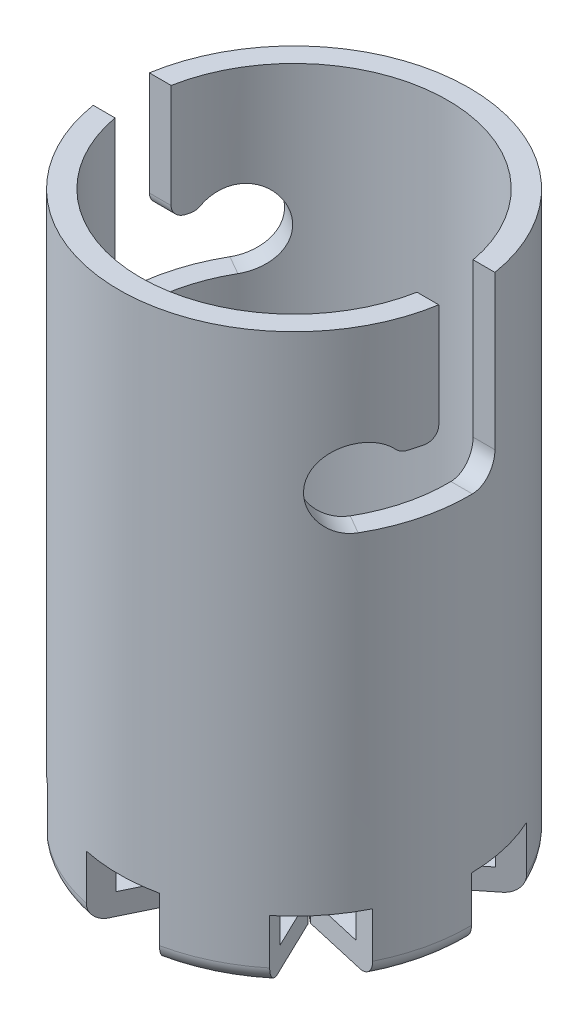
SolidWorks part; units mm, degrees
ref_plane "Front Plane" through (0, 0, 0) normal (0, 0, 1) x (1, 0, 0)
ref_plane "Top Plane" through (0, 0, 0) normal (0, 1, 0) x (1, 0, 0)
ref_plane "Right Plane" through (0, 0, 0) normal (1, 0, 0) x (0, 0, -1)
sketch "Sketch1" plane through (0, 0, 0) normal (0, 1, 0) x (1, 0, 0)
  circle A0 centre (0, 0) radius 5.3848
  dimension "D1" = 10.7696
extrude "Boss-Extrude1" add sketch "Sketch1" against normal blind 17.4752
fillet "Fillet1" radius 0.508 1 edges at (0, -17.4752, 5.3848)
shell "Shell1" thickness 0.6604
sketch "Sketch2" plane through (0, -17.4752, 0) normal (0, -1, 0) x (1, 0, 0)
  circle A0 centre (0, 0) radius 2.3813
  dimension "D1" = 4.7625
extrude "Cut-Extrude1" cut sketch "Sketch2" against normal blind 2.54
sketch "Sketch3" plane through (0, -17.4752, 0) normal (0, -1, 0) x (1, 0, 0)
  line L0 (0, 0) -> (0, -5.6585) construction
  line L1 (1.27, -5.6585) -> (1.27, 0) construction
  line L2 (-1.27, -5.6585) -> (-1.27, -0.8493) construction
  line L3 (-5.2158, -2.5351) -> (-1.4559, 0.4634) construction
  line L4 (-3.6322, -4.521) -> (0.7918, -0.9929) construction
  line L5 (-5.234, 2.4973) -> (-0.5454, 1.4272) construction
  line L6 (-5.7992, 0.021) -> (-0.2826, -1.2382) construction
  line L7 (-1.3109, 5.6492) -> (0.7757, 1.3163) construction
  line L8 (-3.5994, 4.5471) -> (-1.1442, -0.551) construction
  line L9 (3.5994, 4.5471) -> (1.5127, 0.2142) construction
  line L10 (1.3109, 5.6492) -> (-1.1442, 0.551) construction
  line L11 (5.7992, 0.021) -> (1.1106, -1.0492) construction
  line L12 (5.234, 2.4973) -> (-0.2826, 1.2382) construction
  line L13 (3.6322, -4.521) -> (-0.1278, -1.5225) construction
  line L14 (5.2158, -2.5351) -> (0.7918, 0.9929) construction
  line L15 (1.27, -2.6372) -> (1.27, -6.7418)
  line L16 (1.27, -2.6372) -> (4.4454, -5.1695)
  line L17 (1.27, -6.7418) -> (4.4454, -5.1695)
  circle A0 centre (0, -5.6585) radius 1.27 construction
  point P35 (0, 0)
  dimension "D1" = 2.54
  dimension "D2" = 7
extrude "Cut-Extrude2" cut sketch "Sketch3" against normal blind 1.905
pattern_circular "CirPattern1" count 7 over 360 about axis through (0, 0, 0) along (0, 1, 0) of "Cut-Extrude2"
sketch "Sketch4" plane through (0, 0, 0) normal (1, 0, 0) x (0, 0, -1)
  line L0 (0, 0) -> (0, -6.7871) construction
  line L1 (5.3848, 0) -> (-5.3848, 0) construction
  line L2 (-0.8636, -5.4864) -> (0.8636, -5.4864)
  line L3 (-0.8636, -5.4864) -> (-0.8636, 0)
  line L4 (-0.8636, 0) -> (0.8636, 0)
  line L5 (0.8636, -5.4864) -> (0.8636, 0)
  line L6 (-0.8636, -5.4864) -> (0.8636, 0) construction
  line L7 (-0.8636, 0) -> (0.8636, -5.4864) construction
  point P3 (0, -2.7432)
  dimension "D1" = 5.4864
  dimension "D2" = 1.7272
extrude "Cut-Extrude3" cut sketch "Sketch4" against normal through all
sketch "Sketch5" plane through (0, 0, 0) normal (0, 1, 0) x (1, 0, 0)
  line L0 (0, 0) -> (0, -8.763) construction
  line L1 (0, 0) -> (-8.8512, 0) construction
  line L2 (0, 0) -> (5.6121, 9.7205) construction
  line L3 (0, 0) -> (3.0117, 11.2397) construction
  dimension "D1" = 120
  dimension "D2" = 15
ref_plane "Plane1" through (0, 0, 0) normal (-0.866, 0, -0.5) x (-0.5, 0, 0.866)
sketch "Sketch6" plane through (0, 0, 0) normal (-0.866, 0, -0.5) x (-0.5, 0, 0.866)
  line L0 (0, 0) -> (0, -9.1386) construction
  line L1 (0, -5.4864) -> (0, 0) construction
  line L2 (1.9096, -5.4864) -> (-2.98, -5.4864) construction
  line L3 (1.9096, -4.2926) -> (-2.98, -4.2926) construction
  circle A0 centre (0, -4.2926) radius 1.1938
  dimension "D1" = 1.1938
extrude "Cut-Extrude4" cut sketch "Sketch6" along normal through all
ref_plane "Plane2" through (0, 0, 0) normal (0.9659, 0, 0.2588) x (0.2588, 0, -0.9659)
sketch "Sketch8" plane through (0, 0, 0) normal (0.9659, 0, 0.2588) x (0.2588, 0, -0.9659)
  line L0 (-0.5415, -5.4864) -> (-2.2098, -5.4864) construction
  line L1 (0.8382, -5.4864) -> (-1.7018, -5.4864)
  line L2 (0.8382, -3.5814) -> (-1.7018, -3.5814)
  line L3 (0.8382, -5.4864) -> (-2.2098, -5.4864) construction
  line L4 (0.8382, -3.5814) -> (-2.2098, -3.5814) construction
  line L5 (0.8382, -3.5814) -> (0.8382, -5.4864)
  line L6 (-1.7018, -3.5814) -> (-1.7018, -5.4864)
  dimension "D1" = 2.54
  dimension "D3" = 0.508
  dimension "D2" = 1.905
extrude "Cut-Extrude5" cut sketch "Sketch8" against normal through all
sketch "Sketch9" plane through (0, 0, 0) normal (-0.866, 0, -0.5) x (-0.5, 0, 0.866)
  line L0 (0, -4.2926) -> (0, -5.4864)
  line L1 (0, -5.4864) -> (0.8767, -5.4864)
  line L2 (3.4054, -5.4864) -> (0.5671, -5.4864) construction
  line L3 (0.8767, -5.4864) -> (0.8767, -4.2926)
  line L4 (0.8767, -4.2926) -> (0, -4.2926)
  arc A0 (0.9588, -3.5814) -> (0.5671, -5.3431) centre (0, -4.2926) ccw construction
  dimension "D1" = 0.8767
extrude "Cut-Extrude6" cut sketch "Sketch9" along normal through all
fillet "Fillet2" radius 0.762 1 edges at (-4.9799, -5.4864, 0.8636)
fillet "Fillet3" radius 0.381 2 edges at (-4.9799, -3.5814, -0.8636) (-4.777, -3.5814, -1.6508)
pattern_circular "CirPattern2" count 2 over 360 about axis through (0, -17.4752, 0) along (0, 1, 0) of "Fillet3", "Fillet2", "Cut-Extrude5", "Cut-Extrude4", "Cut-Extrude3", "Cut-Extrude6"
sketch "Sketch10" plane through (0, -17.4752, 0) normal (0, -1, 0) x (1, 0, 0)
  line L0 (0, 0) -> (1.27, -2.6372)
  line L1 (1.27, -2.6372) -> (1.3991, -2.9053)
extrude "Cut-Extrude-Thin4" cut sketch "Sketch10" against normal through all thin
pattern_circular "CirPattern3" count 7 over 360 about axis through (0, -17.4752, 0) along (0, 1, 0) of "Cut-Extrude-Thin4"
